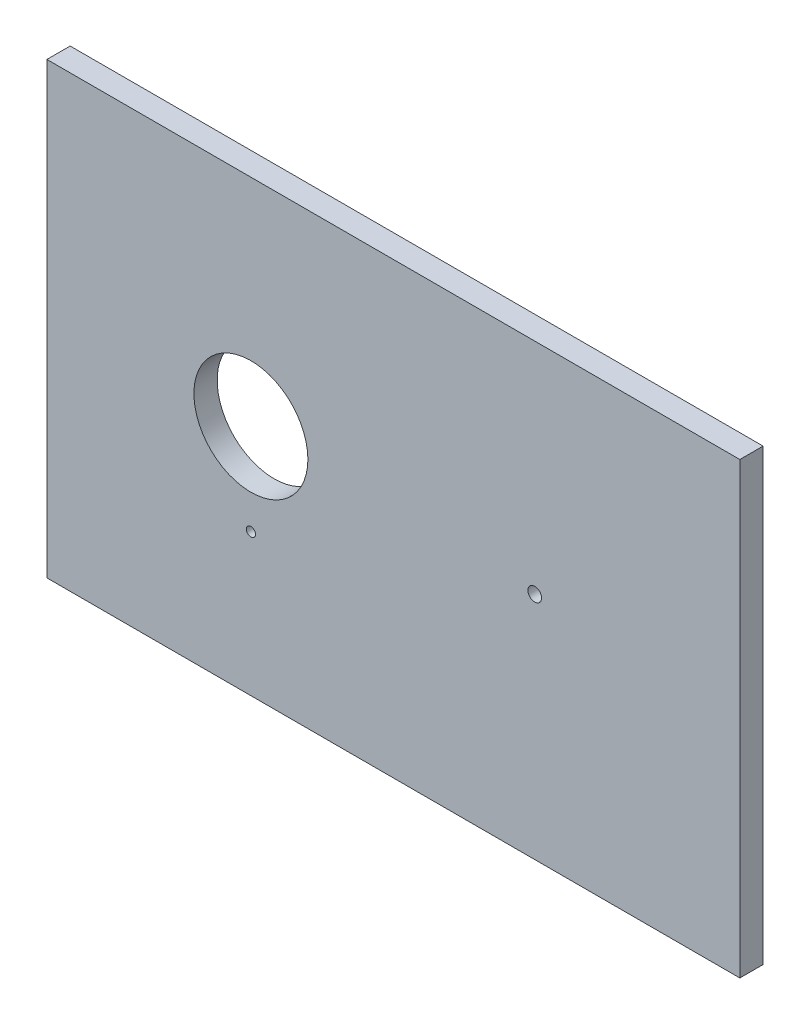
SolidWorks part; units mm, degrees
ref_plane "Plan de face" through (0, 0, 0) normal (0, 0, 1) x (1, 0, 0)
ref_plane "Plan de dessus" through (0, 0, 0) normal (0, 1, 0) x (1, 0, 0)
ref_plane "Plan de droite" through (0, 0, 0) normal (1, 0, 0) x (0, 0, -1)
sketch "Esquisse1" plane through (0, 0, 0) normal (0, 0, 1) x (1, 0, 0)
  line L1 (-152, 98.5) -> (152, 98.5)
  line L2 (-152, 98.5) -> (-152, -98.5)
  line L3 (-152, -98.5) -> (152, -98.5)
  line L4 (152, 98.5) -> (152, -98.5)
  line L5 (-152, 98.5) -> (152, -98.5) construction
  line L6 (-152, -98.5) -> (152, 98.5) construction
  point P0 (0, 0)
  dimension "D1" = 304
  dimension "D2" = 197
extrude "Boss.-Extru.1" add sketch "Esquisse1" along normal mid plane 10.2
extrude "Enlèv. mat.-Extru.1" cut sketch "Esquisse2" against normal blind 35
sketch "Esquisse2" plane through (41.2867, -41.0365, 24.1) normal (0, 0, 1) x (1, 0, 0)
  circle A0 centre (-103.7914, 44.836) radius 25
  circle A1 centre (20.7193, 43.3823) radius 3
extrude "Enlèv. mat.-Extru.2" cut sketch "Esquisse3" against normal through all
sketch "Esquisse3" plane through (41.2867, -41.0365, 29.1) normal (0, 0, 1) x (1, 0, 0)
  circle A0 centre (-103.7914, 4.836) radius 2
